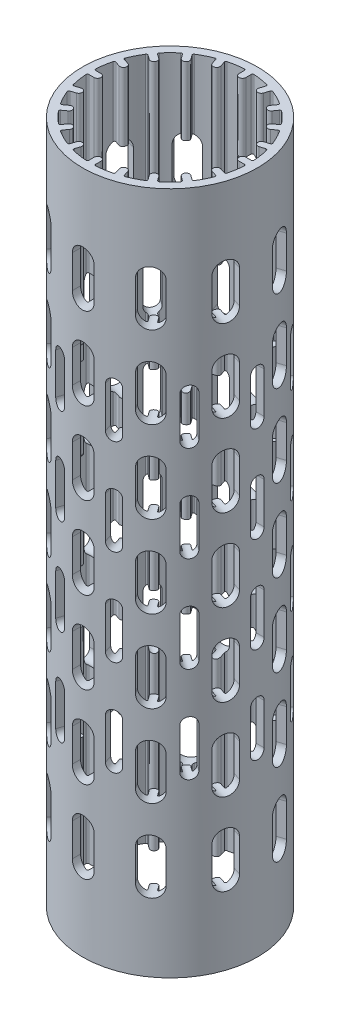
SolidWorks part; units mm, degrees
ref_plane "Front" through (0, 0, 0) normal (0, 0, 1) x (1, 0, 0)
ref_plane "Top" through (0, 0, 0) normal (0, 1, 0) x (1, 0, 0)
ref_plane "Right" through (0, 0, 0) normal (1, 0, 0) x (0, 0, -1)
sketch "Sketch1" plane through (0, 0, 0) normal (0, 1, 0) x (1, 0, 0)
  circle A0 centre (0, 0) radius 32
  circle A1 centre (0, 0) radius 29
  dimension "D1" = 64
  dimension "D2" = 58
extrude "Boss-Extrude1" add sketch "Sketch1" along normal mid plane 250
sketch "Sketch3" plane through (0, 0, 0) normal (0, 1, 0) x (1, 0, 0)
  line L0 (0, 29) -> (0, 26.5) construction
  line L1 (1.25, 28.4462) -> (1.25, 26.5)
  line L3 (-1.7807, 28.9453) -> (-1.7807, 29.5)
  line L4 (-1.7807, 29.5) -> (1.7807, 29.5)
  line L5 (1.7807, 29.5) -> (1.7807, 28.9453)
  line L6 (0, 27.5) -> (0, 29.5) construction
  line L7 (-1.25, 28.4462) -> (-1.25, 26.5)
  circle A0 centre (0, 0) radius 29 construction
  arc A2 (-1.25, 26.5) -> (1.25, 26.5) centre (0, 26.5) ccw
  circle A3 centre (0, 0) radius 29 construction
  arc A4 (1.25, 28.4462) -> (1.7807, 28.9453) centre (1.75, 28.4462) cw
  arc A5 (-1.25, 28.4462) -> (-1.7807, 28.9453) centre (-1.75, 28.4462) ccw
  point P6 (0, 27.5)
  point P7 (-1.0835, 26.1847)
  point P9 (0, 26.3897)
  point P22 (1.6911, 29.4884)
  point P23 (0, 0)
  point P25 (1.1963, 28.3201)
  point P26 (0, 0)
  dimension "D3" = 0.5
  dimension "D4" = 0.5
  dimension "D1" = 2.5
  dimension "D2" = 2.5
extrude "Boss-Extrude2" add sketch "Sketch3" along normal through all and the other way through all
pattern_circular "CirPattern1" count 20 over 360 about axis through (0, 0, 0) along (0, 1, 0) of "Boss-Extrude2"
sketch "Sketch2" plane through (0, 0, 0) normal (0, 0, 1) x (1, 0, 0)
  line L0 (0, -6) -> (0, 6) construction
  line L1 (-4, -6) -> (-4, 6)
  line L2 (4, -6) -> (4, 6)
  arc A0 (-4, -6) -> (4, -6) centre (0, -6) ccw
  arc A1 (4, 6) -> (-4, 6) centre (0, 6) ccw
  point P2 (0, 0)
  dimension "D1" = 8
  dimension "D2" = 12
extrude "Cut-Extrude1" cut sketch "Sketch2" against normal up to next
pattern_linear "LPattern1" count 4 spacing 30 along (0, 1, 0) count 4 spacing 30 along (0, -1, 0) of "Cut-Extrude1"
sketch "Sketch4" plane through (0, 0, 0) normal (1, 0, 0) x (0, 0, -1)
  line L0 (0, 0) -> (15.2839, 0) construction
  line L1 (0, 10) -> (0, 25) construction
  line L2 (-2.5, 10) -> (-2.5, 25)
  line L3 (2.5, 10) -> (2.5, 25)
  line L4 (0, 45) -> (0, 60) construction
  line L5 (-2.5, 45) -> (-2.5, 60)
  line L6 (2.5, 45) -> (2.5, 60)
  line L7 (0, 25) -> (0, 45) construction
  line L8 (0, -10) -> (0, -25) construction
  line L9 (-2.5, -10) -> (-2.5, -25)
  line L10 (2.5, -10) -> (2.5, -25)
  line L11 (0, -45) -> (0, -60) construction
  line L12 (-2.5, -45) -> (-2.5, -60)
  line L13 (2.5, -45) -> (2.5, -60)
  arc A0 (-2.5, 10) -> (2.5, 10) centre (0, 10) ccw
  arc A1 (2.5, 25) -> (-2.5, 25) centre (0, 25) ccw
  arc A2 (-2.5, 45) -> (2.5, 45) centre (0, 45) ccw
  arc A3 (2.5, 60) -> (-2.5, 60) centre (0, 60) ccw
  arc A4 (-2.5, -10) -> (2.5, -10) centre (0, -10) cw
  arc A5 (2.5, -25) -> (-2.5, -25) centre (0, -25) cw
  arc A6 (-2.5, -45) -> (2.5, -45) centre (0, -45) cw
  arc A7 (2.5, -60) -> (-2.5, -60) centre (0, -60) cw
  point P5 (0, 17.5)
  point P10 (0, 52.5)
  point P21 (0, -17.5)
  point P28 (0, -52.5)
  dimension "D1" = 5
  dimension "D2" = 15
  dimension "D3" = 20
  dimension "D4" = 20
extrude "Cut-Extrude2" cut sketch "Sketch4" against normal through all
pattern_circular "CirPattern2" count 10 over 360 about axis through (0, 0, 0) along (0, 1, 0) of "Cut-Extrude1", "Cut-Extrude2", "LPattern1"
